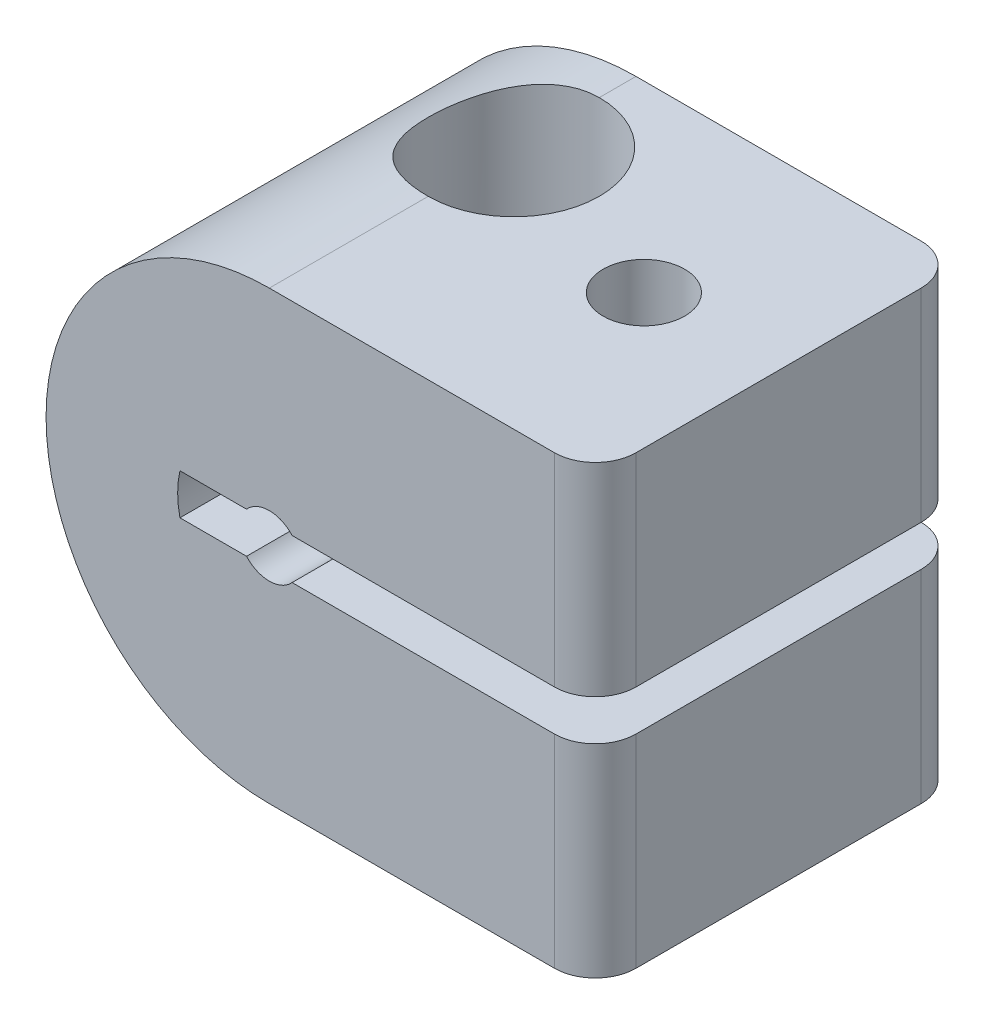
SolidWorks part; units mm, degrees
ref_plane "WL" through (0, 0, 0) normal (0, 0, 1) x (1, 0, 0)
ref_plane "BL" through (0, 0, 0) normal (0, 1, 0) x (1, 0, 0)
ref_plane "STA" through (0, 0, 0) normal (1, 0, 0) x (0, 0, -1)
sketch "Sketch1" plane through (0, 0, 0) normal (0, 0, 1) x (1, 0, 0)
  line L1 (0, 6.9596) -> (10.16, 6.9596)
  line L3 (10.16, 6.9596) -> (10.16, -6.9596)
  line L4 (0, -6.9596) -> (10.16, -6.9596)
  arc A1 (0, 6.9596) -> (0, -6.9596) centre (0, 0) ccw
  dimension "D4" = 13.9192
extrude "Boss-Extrude1" add sketch "Sketch1" along normal blind 5.08
sketch "Sketch6" plane through (0, 0, 5.08) normal (0, 0, 1) x (1, 0, 0)
  circle A0 centre (0, 0) radius 0.9525
  dimension "D1" = 1.905
extrude "Cut-Extrude4" cut sketch "Sketch6" against normal blind 8.89
sketch "Sketch2" plane through (0, 0, 0) normal (0, 0, -1) x (-1, 0, 0)
  line L1 (0, 0) -> (12.8833, 0) construction
  line L4 (-10.16, 6.9596) -> (0, 6.9596) construction
  line L5 (-10.16, -6.9596) -> (-10.16, 6.9596) construction
  line L6 (0, -6.9596) -> (-10.16, -6.9596) construction
  line L7 (-10.16, 6.9596) -> (0, 6.9596)
  line L8 (-10.16, -6.9596) -> (-10.16, 6.9596)
  line L9 (0, -6.9596) -> (-10.16, -6.9596)
  arc A0 (0, -6.9596) -> (0, 6.9596) centre (0, 0) ccw
  arc A3 (0, -6.9596) -> (0, 6.9596) centre (0, 0) ccw construction
extrude "Boss-Extrude2" add sketch "Sketch2" along normal blind 6.35
sketch "Sketch7" plane through (0, 0, -6.35) normal (0, 0, 1) x (1, 0, 0)
  line L1 (0, 0) -> (12.8833, 0) construction
  circle A0 centre (0, 0) radius 2.8575
  dimension "D1" = 5.715
extrude "Cut-Extrude5" cut sketch "Sketch7" along normal blind 7.62
fillet "Fillet1" radius 1.27 2 edges at (10.16, 0, -6.35) (10.16, 0, 5.08)
sketch "Sketch4" plane through (0, 0, -6.35) normal (0, 0, 1) x (1, 0, 0)
  line L0 (11.782, 0) -> (3.1496, 0) construction
  line L1 (10.16, -6.9596) -> (10.16, 6.9596) construction
  line L2 (10.16, 0.635) -> (-2.7861, 0.635)
  line L3 (10.16, 0.635) -> (10.16, -0.635)
  line L4 (10.16, -0.635) -> (-2.7861, -0.635)
  line L10 (-1.905, 0) -> (-10.5328, 0) construction
  circle A3 centre (0, 0) radius 2.8575 construction
  arc A4 (-2.7861, 0.635) -> (-2.7861, -0.635) centre (0, 0) ccw
  dimension "D1" = 1.27
extrude "Cut-Extrude2" cut sketch "Sketch4" along normal through all
sketch "Sketch5" plane through (0, 6.9596, 0) normal (0, 1, 0) x (1, 0, 0)
  line L1 (2.7861, -1.27) -> (2.7861, 6.35) construction
  line L2 (2.7861, -1.27) -> (2.7861, 6.35) construction
  line L4 (10.16, -3.81) -> (10.16, 5.08)
  line L5 (8.89, 6.35) -> (0, 6.35)
  line L6 (0, 6.35) -> (0, -5.08)
  line L7 (0, -5.08) -> (8.89, -5.08)
  line L8 (10.16, -3.81) -> (10.16, 5.08) construction
  line L9 (8.89, 6.35) -> (0, 6.35) construction
  line L10 (0, 6.35) -> (0, -5.08) construction
  line L11 (0, -5.08) -> (8.89, -5.08) construction
  line L14 (0.71, 0.635) -> (10.16, 0.635) construction
  line L16 (0.71, -5.08) -> (0.71, -1.27) construction
  line L18 (0.71, -5.08) -> (0.71, 6.35) construction
  circle A1 centre (5.9611, 0.635) radius 1.27
  arc A4 (10.16, 5.08) -> (8.89, 6.35) centre (8.89, 5.08) ccw
  arc A5 (8.89, -5.08) -> (10.16, -3.81) centre (8.89, -3.81) ccw
  dimension "D2" = 2.54
  dimension "D3" = 3.175
  dimension "D4" = 4.1989
  dimension "D1" = 0
extrude "Cut-Extrude3" cut sketch "Sketch5" against normal through all
sketch "Sketch8" plane through (0, 6.9596, 0) normal (0, 1, 0) x (1, 0, 0)
  line L0 (0, -5.08) -> (0, 6.35) construction
  line L1 (0, 6.35) -> (8.89, 6.35) construction
  circle A0 centre (0, 2.54) radius 2.667
  dimension "D1" = 5.334
  dimension "D2" = 3.81
extrude "Cut-Extrude6" cut sketch "Sketch8" against normal up to surface (6.9596 mm away)
